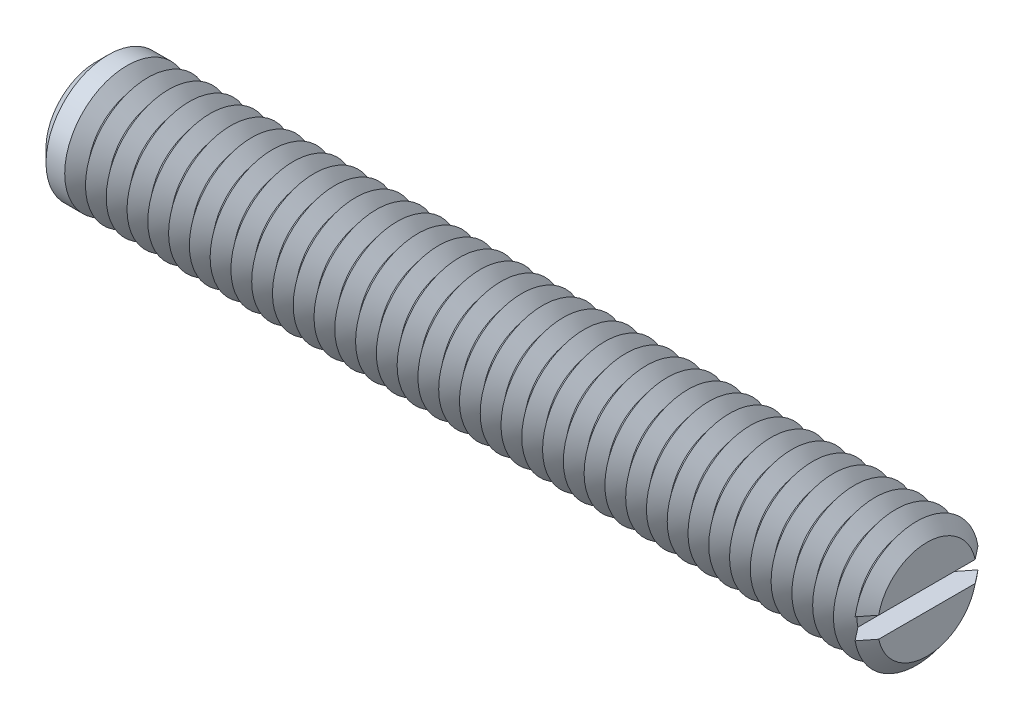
SolidWorks part; units mm, degrees
ref_plane "Front Plane" through (0, 0, 0) normal (0, 0, 1) x (1, 0, 0)
ref_plane "Top Plane" through (0, 0, 0) normal (0, 1, 0) x (1, 0, 0)
ref_plane "Right Plane" through (0, 0, 0) normal (1, 0, 0) x (0, 0, -1)
sketch "Sketch1" plane through (0, 0, 0) normal (1, 0, 0) x (0, 0, -1)
  circle A0 centre (0, 0) radius 3
  dimension "D1" = 6
extrude "Extrude1" add sketch "Sketch1" along normal mid plane 40
sketch "Sketch2" plane through (0, 0, 0) normal (0, 0, 1) x (1, 0, 0)
  line L0 (20, 0.5) -> (19, 0.5)
  line L1 (20, -3) -> (20, 3) construction
  line L2 (19, 0.5) -> (19, -0.5)
  line L3 (0, 0) -> (50000, 0) construction
  line L4 (20, -0.5) -> (19, -0.5)
  line L5 (20, -0.5) -> (20, 0.5)
  point P9 (19, 0)
  dimension "D1" = 1
extrude "Extrude2" cut sketch "Sketch2" against normal mid plane 9
chamfer "Chamfer1" distance 0.6 angle 45 1 edges at (-20, 0, -3)
sketch "Sketch3" plane through (0, 0, 0) normal (0, 0, 1) x (1, 0, 0)
  line L0 (0, 0) -> (30.9602, 0) construction
  line L1 (19.5, -3) -> (20.5, -3)
  line L2 (-19.4, -3) -> (20, -3) construction
  line L3 (20.5, -3) -> (20, -2.3755)
  line L4 (20, -3) -> (20, -0.5) construction
  line L5 (20, -2.3755) -> (19.5, -3)
  dimension "D1" = 1
  dimension "D2" = 0.8
revolve "Cut-Revolve1" cut sketch "Sketch3" angle 360 about L0
pattern_linear "LPattern1" count 39 spacing 1 along (-1, 0, 0) of "Cut-Revolve1"
equation "\"D2@Sketch3\" = \"D1@Sketch3\"*0.8"
